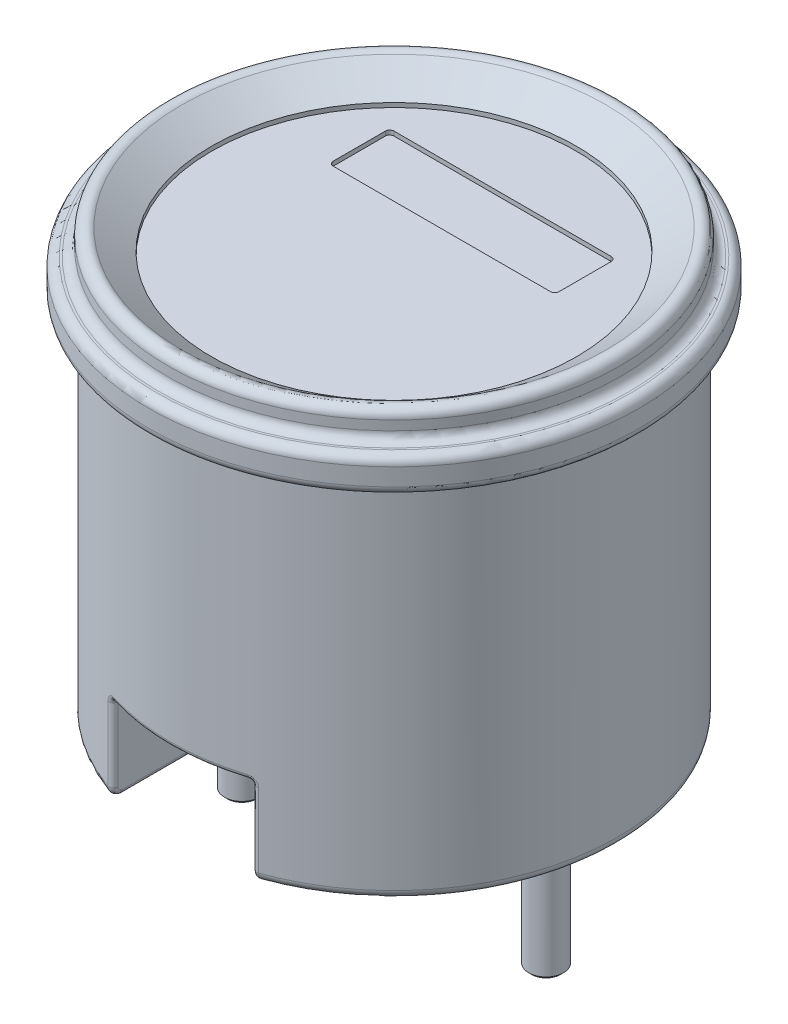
SolidWorks part; units mm, degrees
ref_plane "Plan1" through (0, 0, 0) normal (0, 0, 1) x (1, 0, 0)
ref_plane "Plan2" through (0, 0, 0) normal (0, 1, 0) x (1, 0, 0)
ref_plane "Plan3" through (0, 0, 0) normal (1, 0, 0) x (0, 0, -1)
sketch "Esquisse1" plane through (0, 0, 0) normal (0, 0, 1) x (1, 0, 0)
  line L0 (0, 8.3031) -> (0, -8.3031) construction
  line L1 (0, -42) -> (25.75, -42)
  line L2 (25.75, -42) -> (25.75, 0)
  line L3 (25.75, 0) -> (28.25, 0)
  line L4 (28.25, 0) -> (28.25, 4)
  line L5 (28.25, 4) -> (26, 4)
  line L6 (26, 4) -> (26, 8)
  line L7 (26, 8) -> (21, 4.5)
  line L8 (21, 4.5) -> (21, 4)
  line L9 (21, 4) -> (0, 4)
  line L10 (0, 4) -> (0, -42)
  dimension "D1" = 51.5
  dimension "D2" = 42
  dimension "D3" = 4
  dimension "D4" = 56.5
  dimension "D5" = 42
  dimension "D6" = 4
  dimension "D7" = 8
  dimension "D8" = 52
  dimension "D9" = 0.5
revolve "Base-Révolution" add sketch "Esquisse1" angle 360 about L0
fillet "Congé1" radius 1
sketch "Esquisse2" plane through (0, 4, 0) normal (0, 1, 0) x (-1, 0, 0)
  line L0 (0, 5.7944) -> (0, -5.7944) construction
  line L1 (-12.5, -5.5) -> (12.5, -5.5)
  line L2 (-13, -6) -> (-13, -12)
  line L3 (-12.5, -12.5) -> (12.5, -12.5)
  line L4 (13, -6) -> (13, -12)
  arc A0 (12.5, -5.5) -> (13, -6) centre (12.5, -6) cw
  arc A1 (-12.5, -5.5) -> (-13, -6) centre (-12.5, -6) ccw
  arc A2 (-12.5, -12.5) -> (-13, -12) centre (-12.5, -12) cw
  arc A3 (13, -12) -> (12.5, -12.5) centre (12.5, -12) cw
  point P9 (13, -5.5)
  point P12 (-13, -5.5)
  point P17 (13, -12.5)
  dimension "D4" = 0.5
  dimension "D1" = 26
  dimension "D2" = 5.5
  dimension "D3" = 7
extrude "Enlèv. mat.-Extru.1" cut sketch "Esquisse2" against normal blind 0.5
sketch "Esquisse3" plane through (0, -42, 0) normal (0, -1, 0) x (1, 0, 0)
  line L0 (0, 5.1304) -> (0, -5.1304) construction
  circle A0 centre (17.5, 0) radius 2
  circle A1 centre (-17.5, 0) radius 2
  dimension "D1" = 35
  dimension "D2" = 4
extrude "Boss.-Extru.1" add sketch "Esquisse3" along normal blind 16
chamfer "Chanfrein1" distance 0.35 angle 45
sketch "Esquisse4" plane through (0, -42, 0) normal (0, -1, 0) x (1, 0, 0)
  line L0 (0, 11.0435) -> (0, -11.0435) construction
  line L1 (-8, 25.75) -> (8, 25.75)
  line L2 (-8, 25.75) -> (-8, 12.75)
  line L3 (-8, 12.75) -> (8, 12.75)
  line L4 (8, 25.75) -> (8, 12.75)
  circle A0 centre (0, 0) radius 25.75 construction
  dimension "D1" = 13
  dimension "D2" = 16
extrude "Enlèv. mat.-Extru.2" cut sketch "Esquisse4" against normal blind 10
fillet "Congé2" radius 0.5
